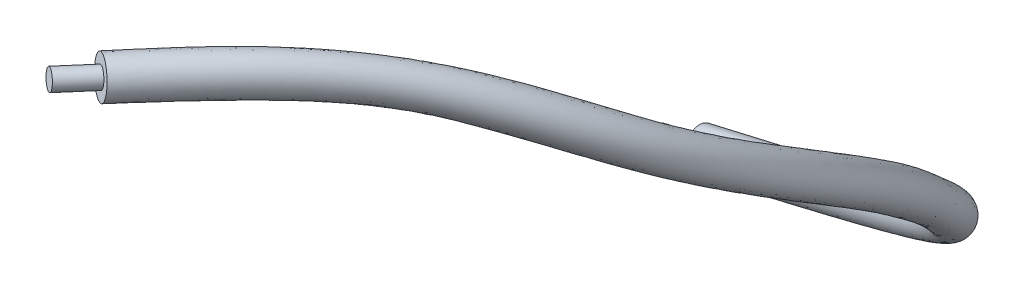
SolidWorks part; units mm, degrees
ref_plane "Plan de face" through (0, 0, 0) normal (0, 0, 1) x (1, 0, 0)
ref_plane "Plan de dessus" through (0, 0, 0) normal (0, 1, 0) x (1, 0, 0)
ref_plane "Plan de droite" through (0, 0, 0) normal (1, 0, 0) x (0, 0, -1)
sketch3d "Esquisse3D1"
  spline S0 degree 3 poles (10.3203, 20.2774, -4.16) (13.0966, 20.6741, -4.4797) (17.3646, 21.2838, -4.9711) (19.3639, 25.9674, -0.4739) (19.2906, 28.5241, 4.6383) (15.677, 31.5011, 9.0551) (13.617, 31.9005, 12.298) (12.5178, 32.1137, 14.0285) knots 0 0 0 0 0.24585 0.377948 0.616161 0.795176 1 1 1 1
ref_plane "Plan2" through (10.3203, 20.2774, -4.16) normal (0.9836, 0.1405, -0.1133) x (-0.1121, -0.016, -0.9936)
sketch "Esquisse2" plane through (10.3203, 20.2774, -4.16) normal (0.9836, 0.1405, -0.1133) x (-0.1121, -0.016, -0.9936)
  circle A0 centre (0, 0) radius 0.5
  dimension "D1" = 1
sweep "Balayage1" add profiles "Esquisse2" path "Esquisse3D1"
sketch "Esquisse3" plane through (13.2502, 1.893, -1.5256) normal (-0.9836, -0.1405, 0.1133) x (0.1121, 0.016, 0.9936)
  circle A2 centre (-2.6514, 18.614) radius 0.25
  circle A3 centre (-2.6514, 18.614) radius 0.25
  dimension "D1" = 0.25
extrude "Extrusion1" add sketch "Esquisse3" along normal blind 1
sketch "Esquisse4" plane through (-4.4921, 0.871, 7.0717) normal (-0.5333, 0.1034, 0.8396) x (0.8459, 0.0652, 0.5293)
  circle A2 centre (20.1082, 30.1578) radius 0.25
  circle A3 centre (20.1082, 30.1578) radius 0.25
  dimension "D1" = 0.25
extrude "Extrusion2" add sketch "Esquisse4" along normal blind 1
